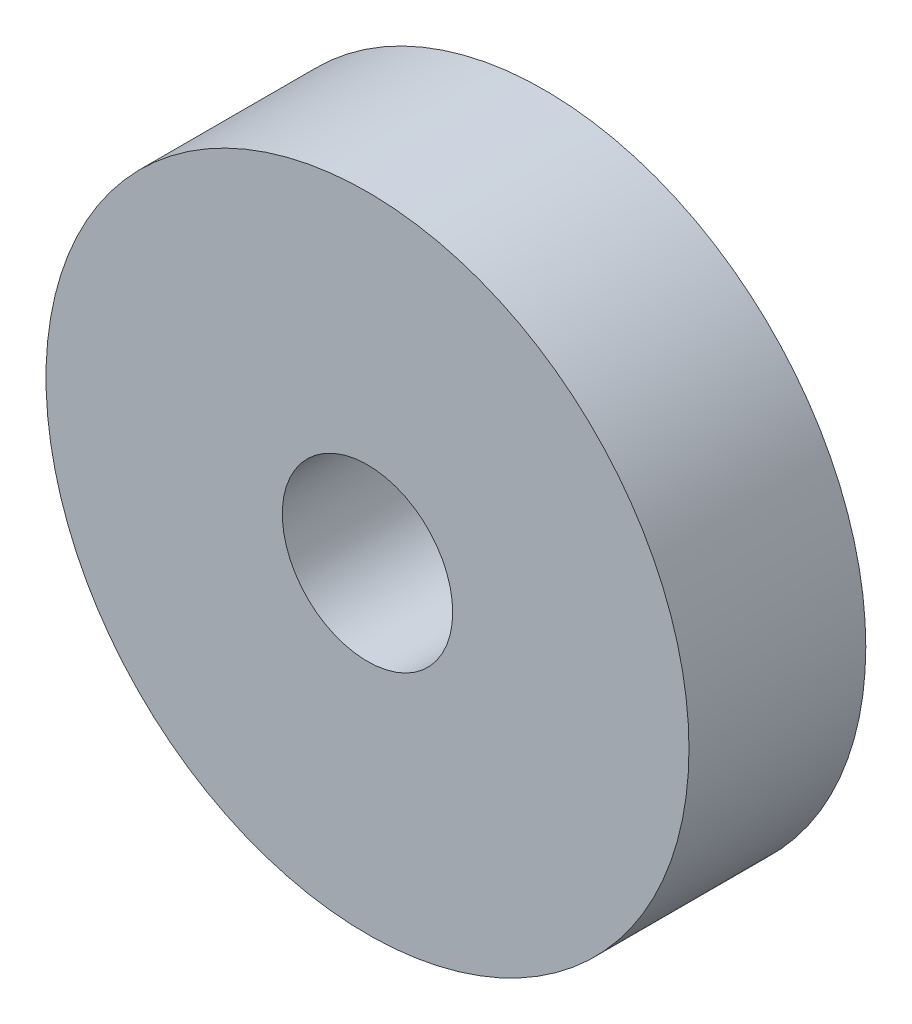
SolidWorks part; units mm, degrees
ref_plane "Płaszczyzna przednia" through (0, 0, 0) normal (0, 0, 1) x (1, 0, 0)
ref_plane "Płaszczyzna górna" through (0, 0, 0) normal (0, 1, 0) x (1, 0, 0)
ref_plane "Płaszczyzna prawa" through (0, 0, 0) normal (1, 0, 0) x (0, 0, -1)
sketch "Szkic1" plane through (0, 0, 0) normal (0, 0, 1) x (1, 0, 0)
  circle A0 centre (0, 0) radius 100
  circle A1 centre (0, 0) radius 26.5
  dimension "D1" = 200
  dimension "D2" = 53
extrude "Dodanie-wyciągnięcie1" add sketch "Szkic1" along normal blind 55
